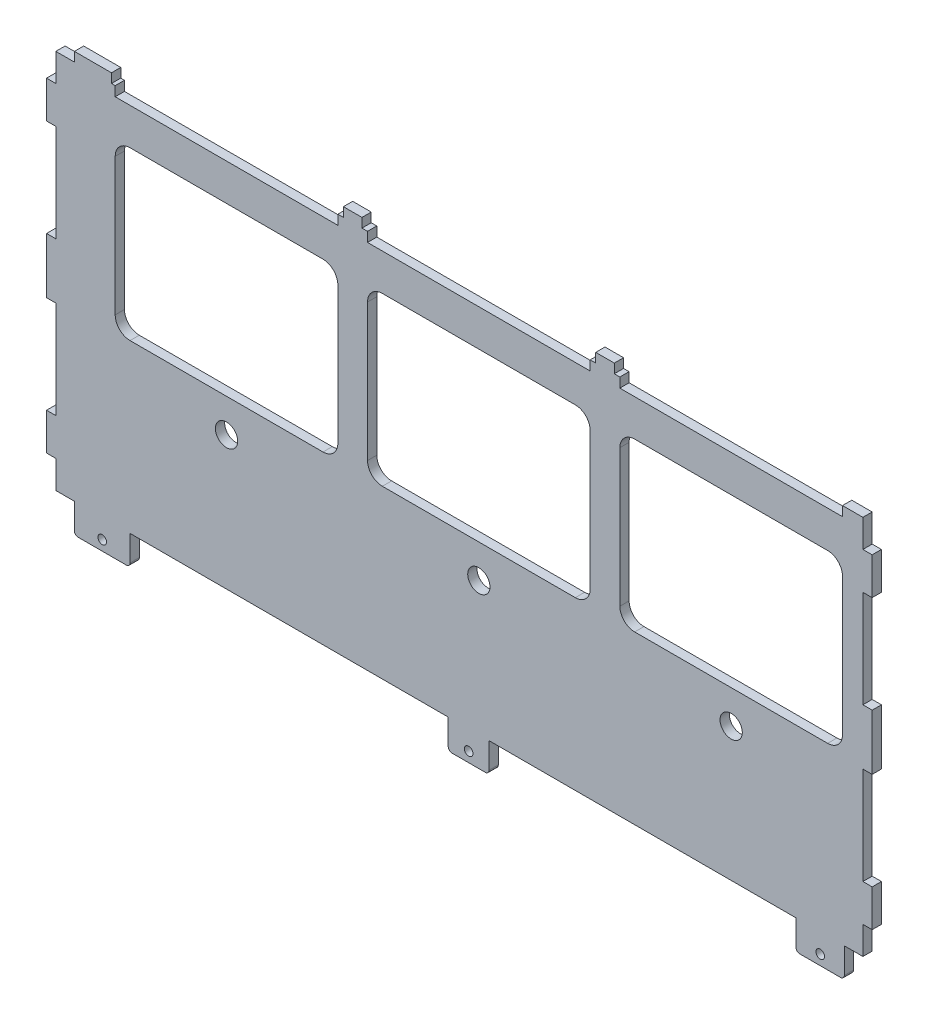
SolidWorks part; units mm, degrees
ref_plane "Front Plane" through (0, 0, 0) normal (0, 0, 1) x (1, 0, 0)
ref_plane "Top Plane" through (0, 0, 0) normal (0, 1, 0) x (1, 0, 0)
ref_plane "Right Plane" through (0, 0, 0) normal (1, 0, 0) x (0, 0, -1)
sketch "Sketch1" plane through (0, 0, 0) normal (0, 0, 1) x (1, 0, 0)
  line L0 (101.6, 130.175) -> (101.6, 0) construction
  line L1 (0, 0) -> (276.225, 0)
  line L2 (0, 0) -> (0, 130.175)
  line L3 (0, 130.175) -> (276.225, 130.175) construction
  line L4 (276.225, 0) -> (276.225, 130.175)
  line L5 (106.68, 114.3) -> (106.68, 57.15)
  line L6 (20.32, 114.3) -> (96.52, 114.3)
  line L7 (20.32, 114.3) -> (20.32, 57.15)
  line L8 (20.32, 57.15) -> (96.52, 57.15)
  line L9 (96.52, 114.3) -> (96.52, 57.15)
  line L10 (182.88, 57.15) -> (106.68, 57.15)
  line L11 (182.88, 114.3) -> (182.88, 57.15)
  line L12 (182.88, 114.3) -> (106.68, 114.3)
  line L13 (58.42, 45.72) -> (144.78, 45.72) construction
  line L14 (144.78, 45.72) -> (231.14, 45.72) construction
  line L15 (144.78, 130.175) -> (144.78, 0) construction
  line L16 (193.04, 114.3) -> (193.04, 57.15)
  line L17 (269.24, 57.15) -> (193.04, 57.15)
  line L18 (269.24, 114.3) -> (269.24, 57.15)
  line L19 (269.24, 114.3) -> (193.04, 114.3)
  line L20 (0, 130.175) -> (20.32, 130.175)
  line L21 (20.32, 130.175) -> (20.32, 126.873)
  line L22 (20.32, 126.873) -> (96.52, 126.873)
  line L23 (96.52, 126.873) -> (96.52, 130.175)
  line L24 (96.52, 130.175) -> (106.68, 130.175)
  line L25 (106.68, 130.175) -> (106.68, 126.873)
  line L26 (106.68, 126.873) -> (182.88, 126.873)
  line L27 (182.88, 126.873) -> (182.88, 130.175)
  line L28 (182.88, 130.175) -> (193.04, 130.175)
  line L29 (193.04, 130.175) -> (193.04, 126.873)
  line L30 (193.04, 126.873) -> (269.24, 126.873)
  line L31 (269.24, 126.873) -> (269.24, 130.175)
  line L32 (269.24, 130.175) -> (276.225, 130.175)
  line L33 (187.96, 130.175) -> (187.96, 0) construction
  circle A0 centre (231.14, 45.72) radius 3.81
  circle A1 centre (58.42, 45.72) radius 3.81
  circle A2 centre (144.78, 45.72) radius 3.81
  point P27 (101.6, 45.72)
  point P28 (58.42, 57.15)
  dimension "D3" = 45.72
  dimension "D5" = 276.225
  dimension "D4" = 7.62
  dimension "D2" = 86.36
  dimension "D6" = 3.302
  dimension "D7" = 45.085
  dimension "D8" = 5.08
  dimension "D9" = 57.15
  dimension "D10" = 57.15
  dimension "D11" = 130.175
extrude "Boss-Extrude1" add sketch "Sketch1" along normal blind 3.175
fillet "Fillet1" radius 5.08 12 edges at (20.32, 57.15, 1.5875) (106.68, 57.15, 1.5875) (106.68, 114.3, 1.5875) (182.88, 114.3, 1.5875) (182.88, 57.15, 1.5875) (96.52, 57.15, 1.5875) (96.52, 114.3, 1.5875) (20.32, 114.3, 1.5875) (269.24, 114.3, 1.5875) (269.24, 57.15, 1.5875) (193.04, 57.15, 1.5875) (193.04, 114.3, 1.5875)
sketch "Sketch2" plane through (0, 0, 0) normal (0, 0, 1) x (1, 0, 0)
  line L0 (193.04, 130.175) -> (182.88, 130.175) construction
  line L1 (0, 65.0875) -> (276.225, 65.0875) construction
  line L2 (0, 130.175) -> (0, 0) construction
  line L3 (276.225, 0) -> (276.225, 130.175) construction
  line L4 (138.1125, 0) -> (138.1125, 126.873) construction
  line L5 (184.785, 130.175) -> (191.135, 130.175)
  line L6 (0, 0) -> (276.225, 0) construction
  line L7 (182.88, 126.873) -> (106.68, 126.873) construction
  line L8 (276.225, 130.175) -> (269.24, 130.175) construction
  line L9 (276.225, 120.65) -> (279.4, 120.65)
  line L10 (276.225, 120.65) -> (276.225, 107.95)
  line L11 (276.225, 107.95) -> (279.4, 107.95)
  line L12 (279.4, 120.65) -> (279.4, 107.95)
  line L13 (279.4, 9.525) -> (279.4, 22.225)
  line L14 (184.785, 130.175) -> (184.785, 133.35)
  line L15 (276.225, 22.225) -> (279.4, 22.225)
  line L16 (276.225, 9.525) -> (276.225, 22.225)
  line L17 (276.225, 9.525) -> (279.4, 9.525)
  line L18 (-3.175, 74.6125) -> (-3.175, 55.5625)
  line L19 (276.225, 74.6125) -> (279.4, 74.6125)
  line L20 (276.225, 74.6125) -> (276.225, 55.5625)
  line L21 (276.225, 55.5625) -> (279.4, 55.5625)
  line L22 (279.4, 74.6125) -> (279.4, 55.5625)
  line L23 (0, 55.5625) -> (-3.175, 55.5625)
  line L24 (0, 74.6125) -> (0, 55.5625)
  line L25 (0, 74.6125) -> (-3.175, 74.6125)
  line L26 (0, 9.525) -> (-3.175, 9.525)
  line L27 (0, 9.525) -> (0, 22.225)
  line L28 (0, 22.225) -> (-3.175, 22.225)
  line L29 (-3.175, 9.525) -> (-3.175, 22.225)
  line L30 (-3.175, 120.65) -> (-3.175, 107.95)
  line L31 (0, 107.95) -> (-3.175, 107.95)
  line L32 (0, 120.65) -> (0, 107.95)
  line L33 (0, 120.65) -> (-3.175, 120.65)
  line L34 (106.68, 130.175) -> (96.52, 130.175) construction
  line L35 (6.35, 0) -> (25.4, 0)
  line L36 (6.35, 0) -> (6.35, -10.033)
  line L37 (6.35, -10.033) -> (25.4, -10.033)
  line L38 (25.4, 0) -> (25.4, -10.033)
  line L39 (134.3025, 0) -> (148.2725, 0)
  line L40 (184.785, 133.35) -> (191.135, 133.35)
  line L41 (191.135, 130.175) -> (191.135, 133.35)
  line L42 (20.32, 130.175) -> (0, 130.175) construction
  line L43 (134.3025, 0) -> (134.3025, -10.033)
  line L44 (134.3025, -10.033) -> (148.2725, -10.033)
  line L45 (148.2725, 0) -> (148.2725, -10.033)
  line L46 (253.365, 0) -> (269.875, 0)
  line L47 (253.365, 0) -> (253.365, -10.033)
  line L48 (253.365, -10.033) -> (269.875, -10.033)
  line L49 (269.875, 0) -> (269.875, -10.033)
  line L50 (98.425, 130.175) -> (104.775, 130.175)
  line L51 (98.425, 130.175) -> (98.425, 133.35)
  line L52 (98.425, 133.35) -> (104.775, 133.35)
  line L53 (104.775, 130.175) -> (104.775, 133.35)
  line L54 (106.68, 130.175) -> (96.52, 130.175) construction
  line L56 (6.35, 130.175) -> (19.05, 130.175)
  line L57 (6.35, 130.175) -> (6.35, 133.35)
  line L58 (6.35, 133.35) -> (19.05, 133.35)
  line L59 (19.05, 130.175) -> (19.05, 133.35)
  point P26 (276.225, 65.0875)
  point P51 (141.2875, -10.033)
  point P58 (101.6, 130.175)
  point P61 (101.6, 130.175)
  point P68 (187.96, 130.175)
  point P69 (187.96, 130.175)
  dimension "D1" = 12.7
  dimension "D2" = 3.175
  dimension "D3" = 9.525
  dimension "D4" = 10.033
  dimension "D5" = 6.35
  dimension "D6" = 6.35
  dimension "D7" = 19.05
  dimension "D8" = 16.51
  dimension "D9" = 3.175
  dimension "D10" = 13.97
  dimension "D11" = 19.05
  dimension "D12" = 6.35
  dimension "D13" = 3.175
  dimension "D14" = 6.35
  dimension "D15" = 12.7
extrude "Boss-Extrude2" add sketch "Sketch2" along normal blind 3.175
hole_wizard "#4 Clearance Hole1" positions "Sketch4" profile "Sketch3" hole size "#4" standard "ANSI Inch"
sketch "Sketch4" plane through (0, 0, 3.175) normal (0, 0, 1) x (1, 0, 0)
  line L12 (148.2725, 0) -> (253.365, 0) construction
  line L16 (6.35, -10.033) -> (25.4, -10.033) construction
  line L17 (134.3025, -10.033) -> (148.2725, -10.033) construction
  line L18 (253.365, -10.033) -> (269.875, -10.033) construction
  point P0 (141.2875, -6.604)
  point P2 (261.62, -6.604)
  point P4 (15.875, -6.604)
  point P62 (15.875, -10.033)
  point P65 (141.2875, -10.033)
  point P68 (261.62, -10.033)
  dimension "D1" = 6.604
sketch "Sketch3" plane through (141.2875, -6.604, 3.175) normal (1, 0, 0) x (0, -1, 0)
  line L0 (0, 0) -> (0, 3.1751)
  line L1 (0, 3.1751) -> (1.4732, 3.1751)
  line L2 (1.4732, 3.1751) -> (1.4732, 0)
  line L5 (1.4732, 0) -> (0, 0)
  line L11 (0, -6.35) -> (0, 107.95) construction
  dimension "Thru Hole Dia." = 2.9464
  dimension "Thru Hole Depth" = 3.1751
fillet "Fillet2" radius 1.27 6 edges at (269.875, -10.033, 1.5875) (253.365, -10.033, 1.5875) (148.2725, -10.033, 1.5875) (134.3025, -10.033, 1.5875) (25.4, -10.033, 1.5875) (6.35, -10.033, 1.5875)
